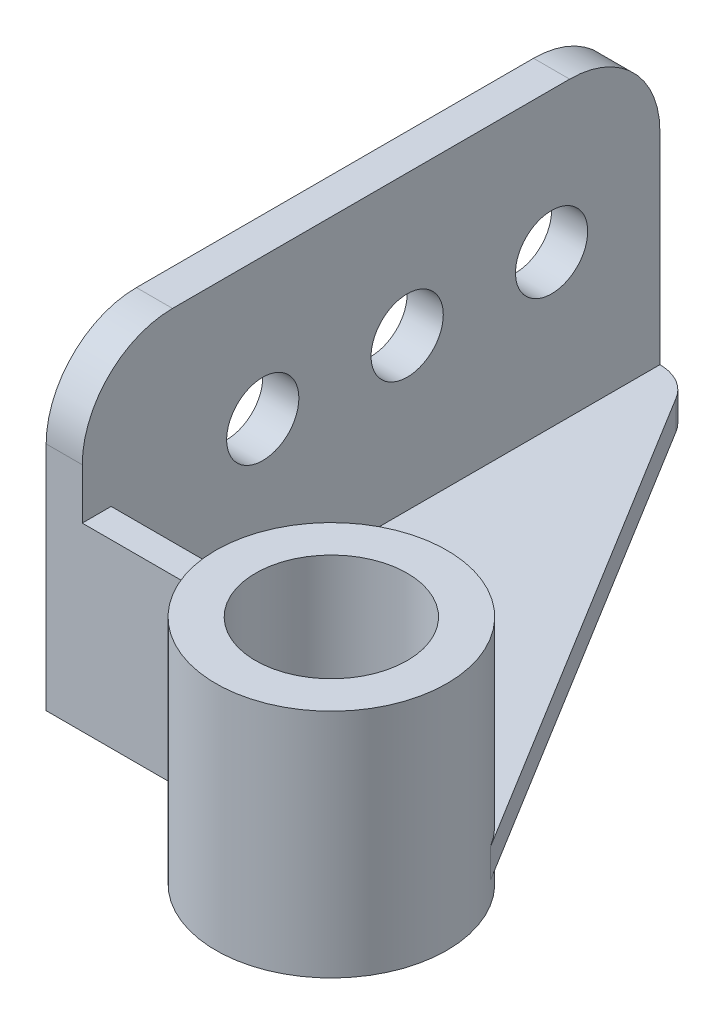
SolidWorks part; units mm, degrees
ref_plane "Front" through (0, 0, 0) normal (0, 0, 1) x (1, 0, 0)
ref_plane "Top" through (0, 0, 0) normal (0, 1, 0) x (1, 0, 0)
ref_plane "Right" through (0, 0, 0) normal (1, 0, 0) x (0, 0, -1)
sketch "Sketch1" plane through (0, 0, 0) normal (1, 0, 0) x (0, 0, 1)
  line L0 (25, 0) -> (135, 0)
  line L1 (0, 25) -> (0, 89)
  line L2 (160, 89) -> (0, 89)
  line L3 (160, 89) -> (160, 25)
  arc A0 (25, 0) -> (0, 25) centre (25, 25) cw
  arc A1 (160, 25) -> (135, 0) centre (135, 25) cw
  dimension "D1" = 25
  dimension "D2" = 25
  dimension "D3" = 89
  dimension "D4" = 160
extrude "Base-Extrude" add sketch "Sketch1" along normal blind 10
sketch "Sketch2" plane through (0, -89, 0) normal (0, -1, 0) x (-1, 0, 0)
  line L0 (0, -160) -> (0, 0) construction
  line L1 (-10, 0) -> (0, 0) construction
  line L2 (-10, -160) -> (-10, 0) construction
  line L3 (-10, -160) -> (-10, 0)
  line L4 (-10, -160) -> (0, -160) construction
  line L5 (-10, -160) -> (-43.251, -160)
  line L6 (-20.2244, -5.7182) -> (-102.2651, -139.2484)
  arc A0 (-102.2651, -139.2484) -> (-43.251, -160) centre (-75, -156) ccw
  arc A1 (-10, 0) -> (-20.2244, -5.7182) centre (-10, -12) ccw
  dimension "D1" = 64
  dimension "D4" = 12
  dimension "D2" = 75
  dimension "D3" = 156
extrude "Boss-Extrude1" add sketch "Sketch2" against normal blind 8
ref_plane "Plane4" through (0, -95, 0) normal (0, -1, 0) x (-1, 0, 0)
sketch "Sketch3" plane through (0, -95, 0) normal (0, -1, 0) x (-1, 0, 0)
  circle A0 centre (-75, -156) radius 32
  arc A1 (-102.2651, -139.2484) -> (-43.251, -160) centre (-75, -156) ccw construction
extrude "Boss-Extrude2" add sketch "Sketch3" against normal blind 64
sketch "Sketch7" plane through (0, -95, 0) normal (0, -1, 0) x (-1, 0, 0)
  circle A0 centre (-75, -156) radius 21
  dimension "D1" = 42
extrude "Cut-Extrude1" cut sketch "Sketch7" against normal through all
sketch "Sketch4" plane through (10, 0, 0) normal (1, 0, 0) x (0, 0, -1)
  line L1 (-152, -81) -> (-152, -25)
  line L2 (-152, -81) -> (-152, -39)
  line L3 (-160, -39) -> (0, -39)
  line L4 (-160, -81) -> (-160, -25) construction
  line L5 (-160, -81) -> (-160, -39)
  line L6 (-160, -81) -> (0, -81) construction
  line L7 (-160, -81) -> (-152, -81)
  line L8 (-160, -39) -> (-152, -39)
  dimension "D1" = 8
  dimension "D2" = 50
extrude "Boss-Extrude3" add sketch "Sketch4" along normal up to next
hole_wizard "Hole1" positions "Sketch5" profile "Sketch6" legacy
sketch "Sketch5" plane through (10, 0, 0) normal (1, 0, 0) x (0, 0, -1)
  line L0 (0, -25) -> (0, -81) construction
  line L2 (-5.7182, -89) -> (-139.2484, -89) construction
  point P0 (-30, -39)
  dimension "D1" = 30
  dimension "D2" = 50
sketch "Sketch6" plane through (10, -39, 30) normal (0, 1, 0) x (0, 0, -1)
  line L0 (0, 0) -> (0, 10)
  line L1 (0, 10) -> (10, 10)
  line L2 (10, 10) -> (10, 0)
  line L3 (10, 0) -> (0, 0)
pattern_linear "LPattern1" count 3 spacing 40 along (0, 0, 1) of "Hole1"
